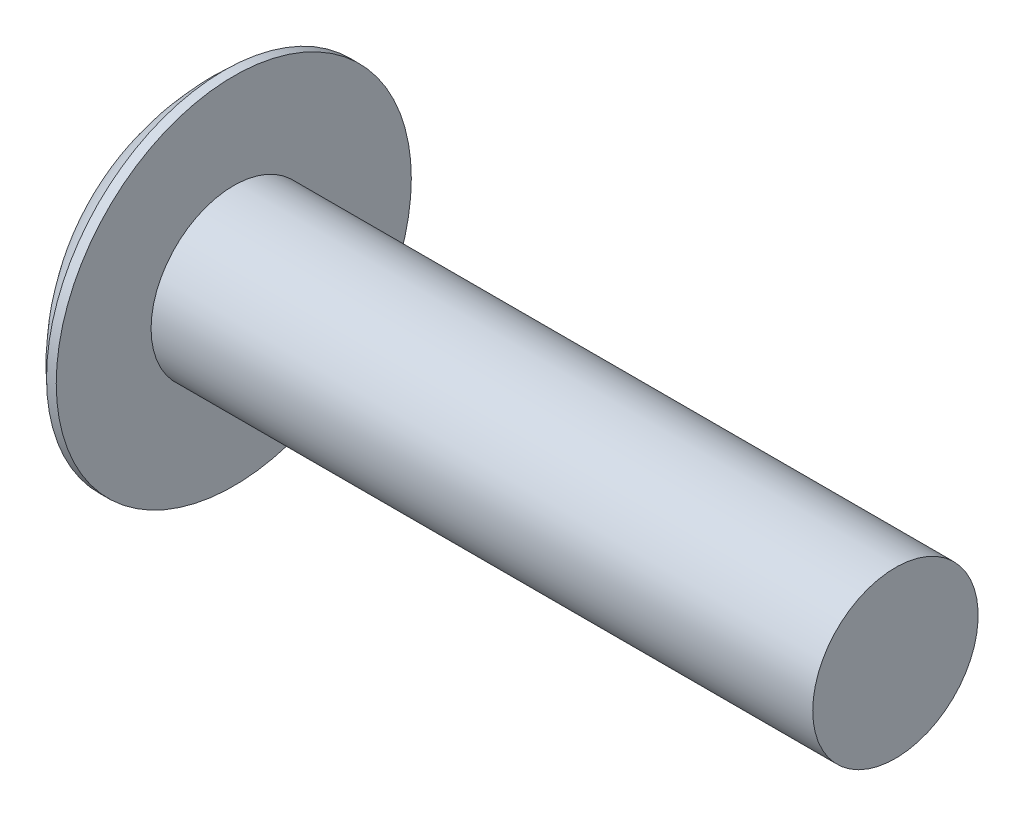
SolidWorks part; units mm, degrees
ref_plane "Plane1" through (0, 0, 0) normal (0, 0, 1) x (1, 0, 0)
ref_plane "Plane2" through (0, 0, 0) normal (0, 1, 0) x (1, 0, 0)
ref_plane "Plane3" through (0, 0, 0) normal (1, 0, 0) x (0, 0, -1)
sketch "BodySke" plane through (0, 0, 0) normal (0, 0, 1) x (1, 0, 0)
  line L0 (5.1562, 4.7625) -> (5.1562, 10.2235)
  line L1 (43.2562, 0) -> (0, 0)
  line L2 (-25.4, 0) -> (127, 0) construction
  line L3 (4.5978, -10.2235) -> (5.1562, -10.2235) construction
  line L4 (5.1562, 4.7625) -> (43.2562, 4.7625)
  line L5 (43.2562, 4.7625) -> (43.2562, 0)
  line L6 (4.5978, 10.2235) -> (5.1562, 10.2235)
  line L7 (5.1562, -4.7625) -> (43.2562, -4.7625) construction
  line L8 (6.7437, 6.35) -> (6.7437, -3.175) construction
  line L9 (11.5062, 6.35) -> (11.5062, -3.175) construction
  arc A0 (4.5978, 10.2235) -> (0, 0) centre (13.6652, 0) ccw
  dimension "Head_rad" = 13.6652
  dimension "Head_ht" = 5.1562
  dimension "Diameter" = 9.525
  dimension "Length" = 38.1
  dimension "Head_dia" = 20.447
  dimension "Advance" = 1.5875
  dimension "Thread_nom" = 31.75
revolve "Base-Revolve" add sketch "BodySke" angle 360 about L2
sketch "Sketch2" plane through (0, 0, 0) normal (1, 0, 0) x (0, 0, -1)
  line L0 (10.2235, -1.1049) -> (-10.2235, -1.1049)
  line L1 (10.2235, -1.1049) -> (10.2235, 1.1049)
  line L2 (-10.2235, 1.1049) -> (10.2235, 1.1049)
  line L3 (-10.2235, 1.1049) -> (-10.2235, -1.1049)
  dimension "D1" = 20.447
  dimension "D2" = 10.2235
  dimension "Slot_width" = 2.2098
  dimension "D3" = 1.1049
extrude "Slot" cut sketch "Sketch2" along normal blind 2.8448
sketch "Sketch3" plane through (0, 0, 0) normal (1, 0, 0) x (0, 0, -1)
  line L0 (1.2319, -7.4676) -> (-1.2319, -7.4676)
  line L1 (1.2319, -7.4676) -> (1.2319, 7.4676)
  line L2 (-1.2319, 7.4676) -> (1.2319, 7.4676)
  line L3 (-1.2319, 7.4676) -> (-1.2319, -7.4676)
  dimension "D1" = 1.2319
  dimension "Cross_width" = 2.4638
  dimension "Cross_dia" = 14.9352
  dimension "D2" = 7.4676
ref_plane "Plane4" through (8.9916, 0, 0) normal (1, 0, 0) x (0, 0, -1)
sketch "Sketch4" plane through (8.9916, 0, 0) normal (1, 0, 0) x (0, 0, -1)
  line L0 (0.616, -0.616) -> (-0.616, -0.6159)
  line L1 (0.616, -0.616) -> (0.616, 0.616)
  line L2 (-0.616, 0.616) -> (0.616, 0.616)
  line L3 (-0.616, 0.616) -> (-0.616, -0.6159)
  dimension "D1" = 1.2319
  dimension "D2" = 0.6159
  dimension "D3" = 1.2319
  dimension "D4" = 0.6159
loft "Cross" cut profiles "Sketch3", "Sketch4"
pattern_circular "CirPattern1" count 2 every 90 about axis through (0, 0, 0) along (1, 0, 0) of "Cross"
sketch "ThdSchSke" plane through (0, 0, 0) normal (0, 0, 1) x (1, 0, 0)
  line L0 (11.5062, -3.9688) -> (10.9504, -4.7625)
  line L1 (11.5062, -3.9688) -> (12.062, -4.7625)
  line L2 (12.062, -4.7625) -> (12.062, -5.9531)
  line L3 (-3.175, 0) -> (5.1513, 0) construction
  line L5 (12.062, -5.9531) -> (10.9504, -5.9531)
  line L6 (10.9504, -5.9531) -> (10.9504, -4.7625)
  dimension "Thread_minor" = 7.9375
  dimension "Diameter" = 9.525
  dimension "Start" = 11.5062
  dimension "SideAngle" = 55
  dimension "VeeAngle" = 70
  dimension "Overcut" = 11.9063
revolve "ThreadSchematic" [suppressed] cut sketch "ThdSchSke" angle 360 about L3
pattern_linear "ThdSchPat" [suppressed]
equation "\"D1@Sketch2\" = \"Head_dia@BodySke\""
equation "\"D2@Sketch2\" = \"D1@Sketch2\" / 2"
equation "\"D3@Sketch2\" = \"Slot_width@Sketch2\" / 2"
equation "\"D1@Sketch3\" = \"Cross_width@Sketch3\" / 2"
equation "\"D2@Sketch3\" = \"Cross_dia@Sketch3\" / 2"
equation "\"D1@Sketch4\" = \"Cross_width@Sketch3\" *.5"
equation "\"D2@Sketch4\" = \"D1@Sketch4\" / 2"
equation "\"D3@Sketch4\" = \"D1@Sketch4\""
equation "\"D4@Sketch4\" = \"D3@Sketch4\" / 2"
equation "\"Thread_length@ThreadCosmetic\" = ((sgn( (\"Length@BodySke\" - \"Advance@BodySke\" ) - \"Thread_nom@BodySke\" )-1)*( (\"Length@BodySke\" - \"Advance@BodySke\" ) - \"Thread_nom@BodySke\" ))/-2+ \"Thread_nom@BodySke\""
equation "\"Thread_minor@ThdSchSke\" = \"Thread_minor@ThreadCosmetic\""
equation "\"Diameter@ThdSchSke\" = \"Diameter@BodySke\""
equation "\"Overcut@ThdSchSke\" = \"Diameter@BodySke\" * 1.25"
equation "\"Start@ThdSchSke\" = \"Head_ht@BodySke\" + \"Length@BodySke\" - \"Thread_length@ThreadCosmetic\"  '---Non-countersunk---"
equation "\"Num_threads@ThdSchPat\" = int( \"Thread_length@ThreadCosmetic\" / \"Advance@BodySke\" + 0.999 )  + 1"
equation "\"Advance@ThdSchPat\" = \"Thread_length@ThreadCosmetic\" /  (\"Num_threads@ThdSchPat\" - 1) 'relax it"
